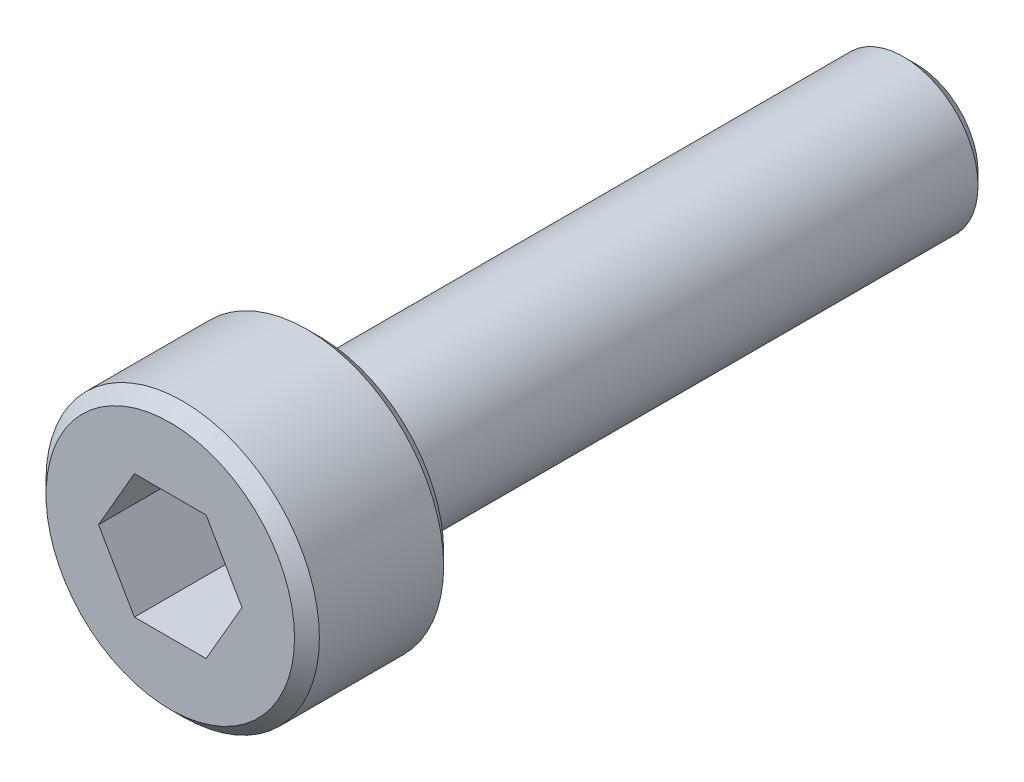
SolidWorks part; units mm, degrees
ref_plane "Front Plane" through (0, 0, 0) normal (1, 0, 0) x (0, 1, 0)
ref_plane "Top Plane" through (0, 0, 0) normal (0, 0, 1) x (0, 1, 0)
ref_plane "Right Plane" through (0, 0, 0) normal (0, 1, 0) x (-1, 0, 0)
sketch "Sketch1" plane through (0, 0, 0) normal (0, 0, 1) x (0, 1, 0)
  circle A0 centre (0, 0) radius 1.5
  dimension "D1" = 3
extrude "Boss-Extrude1" add sketch "Sketch1" along normal blind 12
sketch "Sketch2" plane through (0, 0, 12) normal (0, 0, 1) x (1, 0, 0)
  circle A0 centre (0, 0) radius 2.75
  dimension "D1" = 5.5
extrude "Boss-Extrude2" add sketch "Sketch2" along normal blind 3
chamfer "Chamfer1" distance 0.25 angle 45 3 edges at (2.75, 0, 12) (1.5, 0, 0) (2.75, 0, 15)
sketch "Sketch3" plane through (0, 0, 15) normal (0, 0, 1) x (1, 0, 0)
  line L1 (1.4434, 0) -> (0.7217, 1.25)
  line L2 (0.7217, 1.25) -> (-0.7217, 1.25)
  line L3 (-0.7217, 1.25) -> (-1.4434, 0)
  line L4 (-1.4434, 0) -> (-0.7217, -1.25)
  line L5 (-0.7217, -1.25) -> (0.7217, -1.25)
  line L6 (0.7217, -1.25) -> (1.4434, 0)
  circle A0 centre (0, 0) radius 1.25 construction
  dimension "D1" = 2.5
extrude "Cut-Extrude1" cut sketch "Sketch3" against normal blind 2
